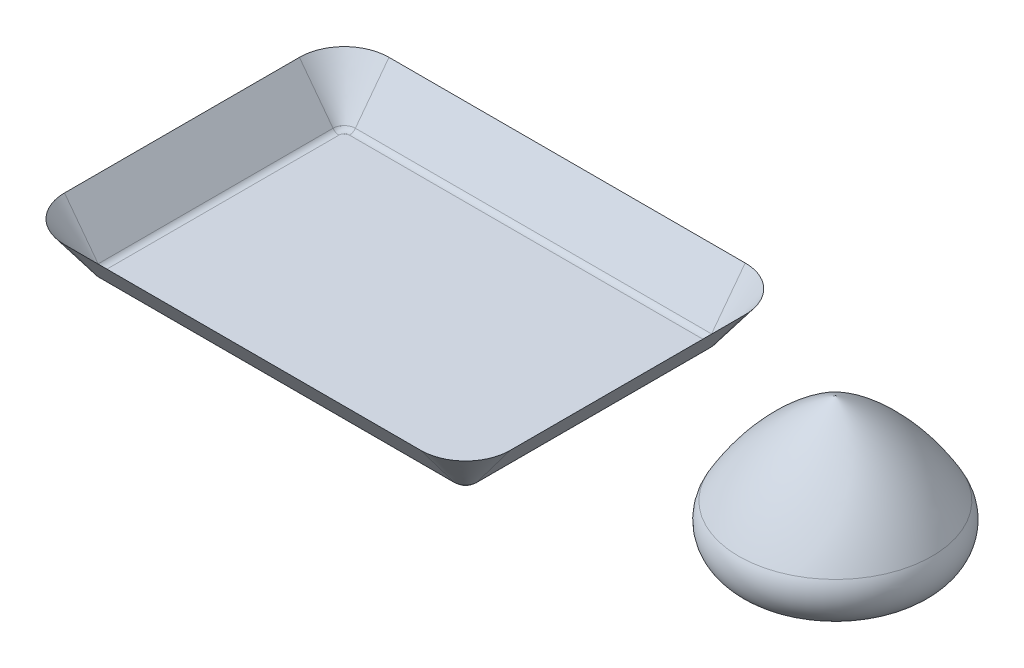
SolidWorks part; units mm, degrees
ref_plane "Front Plane" through (0, 0, 0) normal (0, 0, 1) x (1, 0, 0)
ref_plane "Top Plane" through (0, 0, 0) normal (0, 1, 0) x (1, 0, 0)
ref_plane "Right Plane" through (0, 0, 0) normal (1, 0, 0) x (0, 0, -1)
sketch "Sketch1" plane through (0, 0, 0) normal (0, 0, 1) x (1, 0, 0)
  line L0 (0, 0) -> (58.1344, 0)
  line L1 (0, 119.3114) -> (0, 0) construction
  arc A0 (58.1344, 0) -> (82.3118, 41.8351) centre (58.1344, 27.9039) ccw
  arc A1 (82.3118, 41.8351) -> (0, 119.3114) centre (-87.2931, -55.8926) ccw
surface "Surface-Revolve1" sketch "Sketch1" parameters "D1"=360
sketch "Sketch2" plane through (0, 0, 0) normal (0, 1, 0) x (1, 0, 0)
  line L1 (-518.9276, -107.7519) -> (-215.222, -107.7519)
  line L2 (-526.5476, -100.1319) -> (-526.5476, 100.1319)
  line L3 (-518.9276, 107.7519) -> (-215.222, 107.7519)
  line L4 (-207.602, -100.1319) -> (-207.602, 100.1319)
  line L5 (-526.5476, -107.7519) -> (-207.602, 107.7519) construction
  line L6 (-526.5476, 107.7519) -> (-207.602, -107.7519) construction
  arc A0 (-215.222, 107.7519) -> (-207.602, 100.1319) centre (-215.222, 100.1319) cw
  arc A1 (-518.9276, -107.7519) -> (-526.5476, -100.1319) centre (-518.9276, -100.1319) cw
  arc A2 (-215.222, -107.7519) -> (-207.602, -100.1319) centre (-215.222, -100.1319) ccw
  arc A3 (-526.5476, 100.1319) -> (-518.9276, 107.7519) centre (-518.9276, 100.1319) cw
  point P0 (-367.0748, 0)
  dimension "D1" = 7.62
surface "Surface-Plane1" sketch "Sketch2"
other "Ruled Surface1" parameters "D1"=50.8, "D2"=37
surface "Surface-Knit1"
fillet "Fillet3" radius 6.35 8 edges at (-207.602, 0, 0) (-367.0748, 0, -107.7519) (-526.5476, 0, 0) (-367.0748, 0, 107.7519) (-524.3158, 0, 105.5201) (-524.3158, 0, -105.5201) (-209.8339, 0, -105.5201) (-209.8339, 0, 105.5201)
